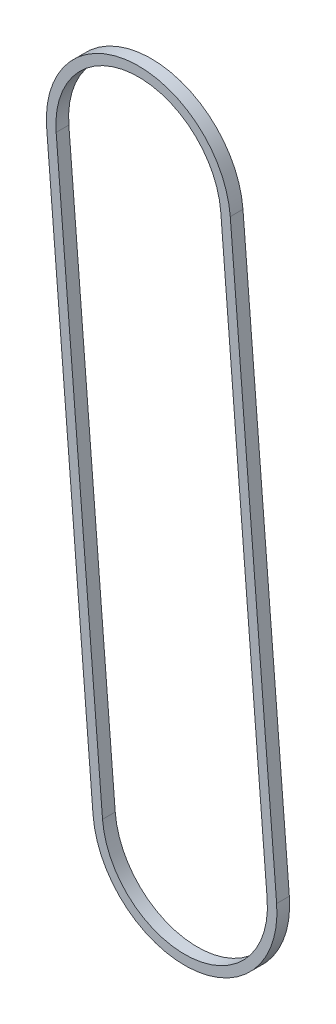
SolidWorks part; units mm, degrees
ref_plane "Front Plane" through (0, 0, 0) normal (0, 0, 1) x (1, 0, 0)
ref_plane "Top Plane" through (0, 0, 0) normal (0, 1, 0) x (1, 0, 0)
ref_plane "Right Plane" through (0, 0, 0) normal (1, 0, 0) x (0, 0, -1)
sketch "Sketch1" plane through (0, 0, 0) normal (0, 0, 1) x (1, 0, 0)
  line L0 (-144.5254, -11.7226) -> (144.5254, 11.7226) construction
  line L1 (-202.5745, 889.4901) -> (-129.5745, -10.5099)
  line L2 (56.5745, 910.5099) -> (129.5745, 10.5099)
  line L3 (-217.5254, 888.2774) -> (-144.5254, -11.7226)
  line L4 (71.5254, 911.7226) -> (144.5254, 11.7226)
  line L5 (71.5254, 911.7226) -> (-217.5254, 888.2774) construction
  line L6 (-73, 900) -> (0, 0) construction
  arc A0 (71.5254, 911.7226) -> (-217.5254, 888.2774) centre (-73, 900) ccw
  arc A1 (-129.5745, -10.5099) -> (129.5745, 10.5099) centre (0, 0) ccw
  arc A2 (56.5745, 910.5099) -> (-202.5745, 889.4901) centre (-73, 900) ccw
  arc A3 (-144.5254, -11.7226) -> (144.5254, 11.7226) centre (0, 0) ccw
  dimension "D1" = 15
  dimension "D2" = 900
  dimension "D3" = 130
  dimension "D4" = 73
extrude "Boss-Extrude1" add sketch "Sketch1" along normal mid plane 20 contours L3 A3 L4 A0 | A1 L2 A2 L1
